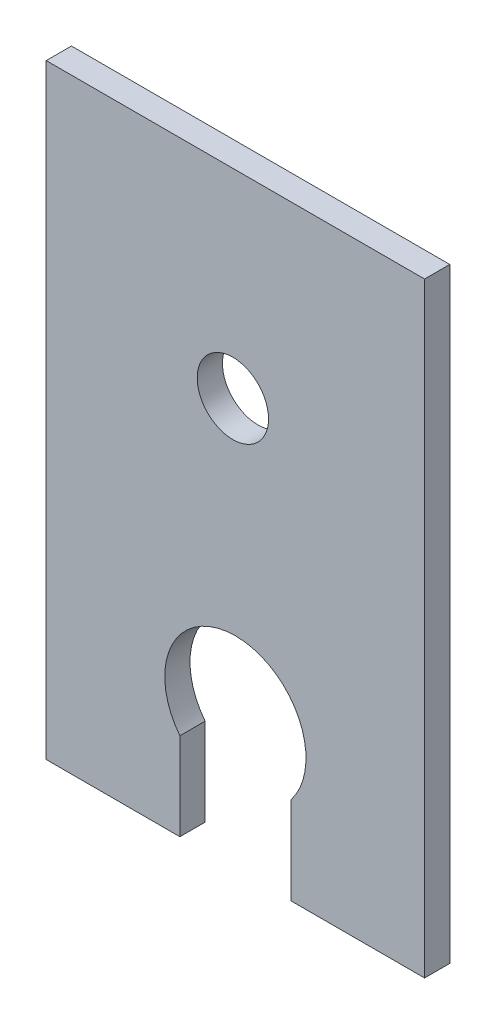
SolidWorks part; units mm, degrees
ref_plane "Plan1" through (0, 0, 0) normal (0, 0, 1) x (1, 0, 0)
ref_plane "Plan2" through (0, 0, 0) normal (0, 1, 0) x (1, 0, 0)
ref_plane "Plan3" through (0, 0, 0) normal (1, 0, 0) x (0, 0, -1)
sketch "Esquisse1" plane through (0, 0, 0) normal (0, 0, 1) x (1, 0, 0)
  line L1 (0, 0) -> (150, 0)
  line L2 (0, 0) -> (0, 240)
  line L3 (0, 240) -> (150, 240)
  line L4 (150, 0) -> (150, 240)
extrude "Base-Extrusion" add sketch "Esquisse1" along normal blind 10
sketch "Esquisse2" plane through (0, 0, 10) normal (0, 0, 1) x (1, 0, 0)
  line L0 (0, 0) -> (150, 0) construction
  line L1 (53, 0) -> (97, 0)
  line L2 (53, 0) -> (53, 34.6795)
  line L4 (97, 0) -> (97, 34.6795)
  arc A0 (97, 34.6795) -> (53, 34.6795) centre (75, 52) ccw
extrude "Enlèv. mat.-Extru.1" cut sketch "Esquisse2" against normal blind 10
sketch "Esquisse3" plane through (0, 0, 10) normal (0, 0, 1) x (1, 0, 0)
  circle A0 centre (74, 161) radius 14.1421
extrude "Enlèv. mat.-Extru.2" cut sketch "Esquisse3" against normal blind 10
